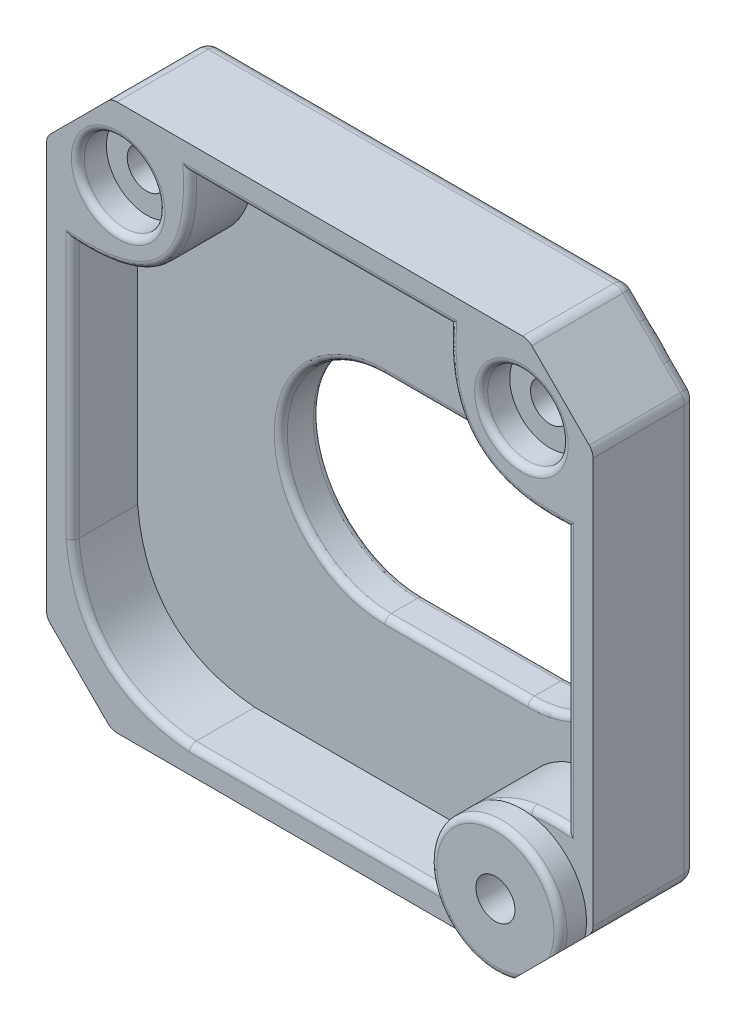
SolidWorks part; units mm, degrees
other "Камера1"
ref_plane "Спереди" through (0, 0, 0) normal (0, 0, 1) x (1, 0, 0)
ref_plane "Сверху" through (0, 0, 0) normal (0, 1, 0) x (1, 0, 0)
ref_plane "Справа" through (0, 0, 0) normal (1, 0, 0) x (0, 0, -1)
sketch "Эскиз1" plane through (0, 0, 0) normal (0, 0, 1) x (1, 0, 0)
  line L0 (-30.7762, 0) -> (39.5751, 0) construction
  line L1 (-16, -21) -> (16, -21)
  line L2 (-21, -16) -> (-21, 16)
  line L3 (-16, 21) -> (16, 21)
  line L4 (21, -16) -> (21, 16)
  line L5 (-21, 16) -> (-16, 21)
  line L6 (16, 21) -> (21, 16)
  line L7 (0, 27.8287) -> (0, -28.6571) construction
  line L8 (16, -21) -> (21, -16)
  line L9 (-21, -16) -> (-16, -21)
  circle A1 centre (-15.5, 15.5) radius 1.5
  circle A2 centre (15.5, 15.5) radius 1.5
  circle A4 centre (15.5, -15.5) radius 1.5
  circle A5 centre (-15.5, -15.5) radius 1.5
  point P0 (0, 0)
  point P1 (21, 21)
  point P2 (-21, -21)
  point P3 (-21, 21)
  point P4 (21, -21)
  dimension "D5" = 3
  dimension "D6" = 3
  dimension "D1" = 42
  dimension "D2" = 42
  dimension "D4" = 31
  dimension "D7" = 15.5
  dimension "D8" = 15.5
  dimension "D9" = 5.5
  dimension "D10" = 5.5
  dimension "D11" = 5.5
  dimension "D12" = 2
extrude "Бобышка-Вытянуть1" add sketch "Эскиз1" along normal blind 8
sketch "Эскиз46" plane through (0, 0, 8) normal (0, 0, 1) x (1, 0, 0)
  circle A0 centre (-15.5, 15.5) radius 3.1
  circle A1 centre (15.5, 15.5) radius 3.1
  dimension "D1" = 6.2
  dimension "D2" = 6.2
extrude "Вырез-Вытянуть7" cut sketch "Эскиз46" against normal blind 2.2
sketch "Эскиз47" plane through (0, 0, 8) normal (0, 0, 1) x (1, 0, 0)
  line L0 (-21, 16) -> (-21, -16) construction
  line L2 (-10, -19) -> (10, -19)
  line L4 (-10, 19) -> (10, 19)
  line L7 (-21, -16) -> (-16, -21) construction
  line L8 (-19, -9.9984) -> (-19, 10.0016)
  line L10 (19, -9.9984) -> (19, 10.0016)
  line L13 (16, 21) -> (-16, 21) construction
  line L22 (21, -16) -> (21, 16) construction
  line L23 (-16, -21) -> (16, -21) construction
  circle A6 centre (15.5, 15.5) radius 1.5 construction
  circle A7 centre (-15.5, 15.5) radius 1.5 construction
  circle A8 centre (15.5, -15.5) radius 1.5 construction
  spline S0 degree 2 poles (-10, 19) (-9.4314, 9.4256) (-19, 10.0016) knots 0 0 0 1 1 1
  spline S1 degree 2 poles (10, 19) (9.4127, 9.4447) (19, 10.0016) knots 0 0 0 1 1 1
  spline S2 degree 2 poles (19, -9.9984) (9.4295, -9.4292) (10, -19) knots 0 0 0 1 1 1
  spline S3 degree 2 poles (-19, -9.9984) (-18.2583, -18.2572) (-10, -19) knots 0 0 0 1 1 1
  point P11 (0, 0)
  point P13 (0, 0)
  dimension "D2" = 11
  dimension "D3" = 11
  dimension "D4" = 10.9984
  dimension "D15" = 5
  dimension "D16" = 5
  dimension "D18" = 3
  dimension "D17" = 5
  dimension "D5" = 10.9984
  dimension "D6" = 11
  dimension "D7" = 2
  dimension "D8" = 2
  dimension "D9" = 20
  dimension "D10" = 20
  dimension "D11" = 2
  dimension "D12" = 20
  dimension "D13" = 20
  dimension "D14" = 2
extrude "Вырез-Вытянуть8" cut sketch "Эскиз47" against normal blind 5
sketch "Эскиз48" plane through (0, 0, 8) normal (0, 0, 1) x (1, 0, 0)
  circle A0 centre (15.5, -15.5) radius 5
  circle A1 centre (15.5, -15.5) radius 1.5
  dimension "D1" = 10
extrude "Бобышка-Вытянуть2" add sketch "Эскиз48" along normal blind 2
sketch "Эскиз49" plane through (0, 0, 0) normal (0, 0, -1) x (-1, 0, 0)
  line L0 (-21, -16) -> (-16, -21)
  line L1 (-16, -21) -> (-17.9128, -22.4817)
  line L2 (-17.9128, -22.4817) -> (-22.3792, -17.647)
  line L3 (-22.3792, -17.647) -> (-21, -16)
extrude "Вырез-Вытянуть9" cut sketch "Эскиз49" against normal through all
fillet "Скругление1" radius 0.5 1 edges at (11.9645, -11.9645, 10)
fillet "Скругление2" radius 0.5 2 edges at (-12.4, 15.5, 8) (18.6, 15.5, 8)
sketch "Эскиз50" plane through (0, 0, 3) normal (0, 0, 1) x (1, 0, 0)
  line L0 (19, -9.9984) -> (19, 10.0016) construction
  line L1 (0, 8) -> (11, 8)
  line L2 (0, -8) -> (11, -8)
  arc A0 (0, 8) -> (0, -8) centre (0, 0) ccw
  arc A1 (11, -8) -> (11, 8) centre (11, 0) ccw
  dimension "D1" = 16
  dimension "D2" = 16
  dimension "D3" = 8
  dimension "D4" = 11
extrude "Вырез-Вытянуть10" cut sketch "Эскиз50" against normal through all
sketch "Эскиз51" plane through (0, 0, 0) normal (0, 0, -1) x (-1, 0, 0)
  circle A0 centre (-15.5, 15.5) radius 3
  circle A1 centre (15.5, 15.5) radius 3
  circle A2 centre (-15.5, -15.5) radius 3
  dimension "D1" = 6
  dimension "D2" = 6
  dimension "D3" = 6
extrude "Вырез-Вытянуть11" cut sketch "Эскиз51" against normal blind 2
fillet "Скругление4" radius 0.5 3 edges at (12.5, -15.5, 0) (-18.5, 15.5, 0) (12.5, 15.5, 0)
fillet "Скругление5" radius 1 16 edges at (-18.5, -18.5, 0) (0, -21, 0) (18.5, -18.5, 0) (21, 0, 0) (18.5, 18.5, 0) (-18.5, 18.5, 0) (0, 21, 0) (-21, 0, 0) (-21, 16, 4) (-16, 21, 4) (-21, -16, 4) (-16, -21, 4) (16, -21, 4) (21, -16, 4) (21, 16, 4) (16, 21, 4)
fillet "Скругление6" radius 0.5 9 edges at (19, 0.0016, 8) (0, -19, 8) (-19, 0.0016, 8) (0, 19, 8)
fillet "Скругление7" radius 0.5 9 edges at (-8, 0, 3) (-8, 0, 0) (5.5, 8, 3) (16.6569, 5.6569, 3) (16.6569, -5.6569, 3) (5.5, -8, 3) (5.5, 8, 0) (19, 0, 0) (5.5, -8, 0)
